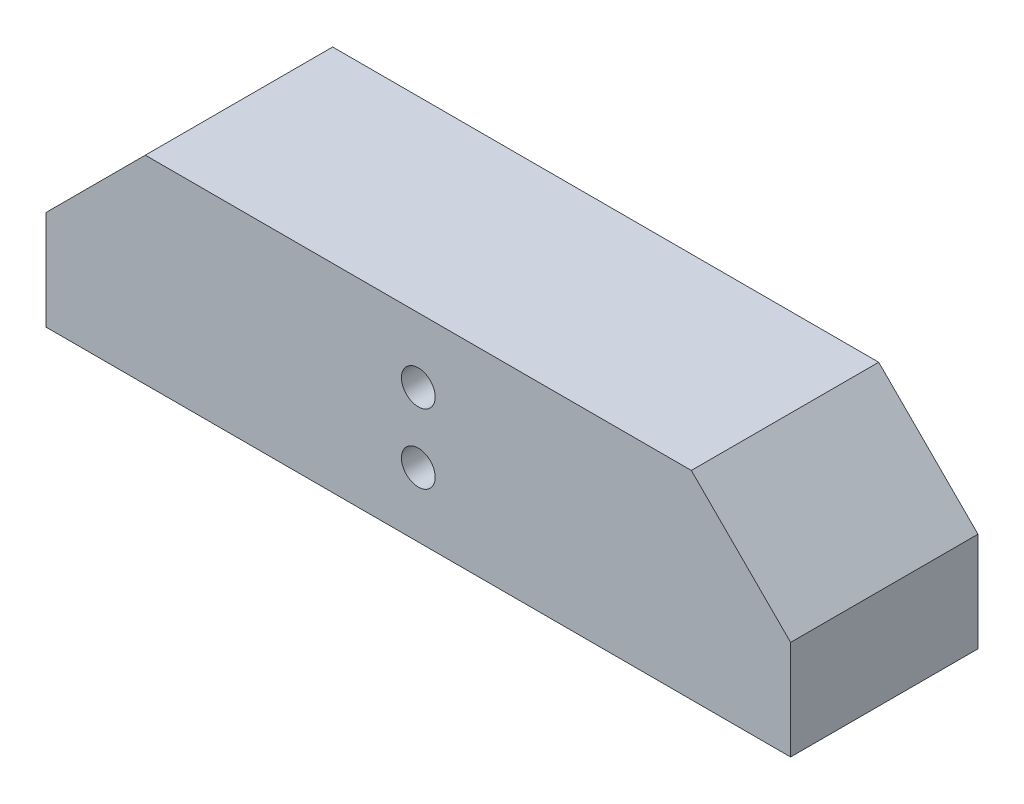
SolidWorks part; units mm, degrees
ref_plane "Front Plane" through (0, 0, 0) normal (0, 0, 1) x (1, 0, 0)
ref_plane "Top Plane" through (0, 0, 0) normal (0, 1, 0) x (1, 0, 0)
ref_plane "Right Plane" through (0, 0, 0) normal (1, 0, 0) x (0, 0, -1)
sketch "Sketch1" plane through (0, 0, 0) normal (0, 0, 1) x (1, 0, 0)
  line L0 (-31.7335, -20) -> (31.7335, -20)
  line L1 (-75, -20) -> (-58.2665, -20)
  line L2 (-75, -20) -> (-75, 20)
  line L3 (-75, 20) -> (75, 20)
  line L4 (75, -20) -> (75, 20)
  line L5 (-75, -20) -> (75, 20) construction
  line L6 (-75, 20) -> (75, -20) construction
  line L7 (58.2665, -20) -> (75, -20)
  arc A0 (-31.7335, -20) -> (-58.2665, -20) centre (-45, -13) ccw
  arc A1 (58.2665, -20) -> (31.7335, -20) centre (45, -13) ccw
  point P0 (0, 0)
  dimension "D3" = 30
  dimension "D4" = 7
  dimension "D1" = 40
  dimension "D2" = 150
  dimension "D5" = 7
  dimension "D6" = 45
  dimension "D7" = 45
extrude "Boss-Extrude1" add sketch "Sketch1" along normal blind 10
fillet "Fillet1" radius 2 4 edges at (31.7335, -20, 5) (58.2665, -20, 5) (-31.7335, -20, 5) (-58.2665, -20, 5)
sketch "Sketch2" plane through (0, 0, 10) normal (0, 0, 1) x (1, 0, 0)
  line L0 (-75, -20) -> (-61.2481, -20) construction
  arc A0 (-30.6635, -17.4118) -> (-59.3365, -17.4118) centre (-45, -13) ccw construction
  circle A1 centre (-66.9, -17) radius 1
  arc A2 (59.3365, -17.4118) -> (30.6635, -17.4118) centre (45, -13) ccw construction
  circle A3 centre (-23.1, -17) radius 1
  circle A4 centre (23.1, -17) radius 1
  circle A5 centre (66.9, -17) radius 1
  point P0 (-66.9, -17)
  point P8 (-23.1, -17)
  point P9 (66.9, -17)
  point P10 (23.1, -17)
  dimension "D1" = 21.9
  dimension "D4" = 21.9
  dimension "D6" = 2
  dimension "D2" = 3
  dimension "D3" = 21.9
  dimension "D5" = 21.9
extrude "Cut-Extrude1" cut sketch "Sketch2" against normal blind 10
sketch "Sketch4" plane through (0, 0, 10) normal (0, 0, 1) x (1, 0, 0)
  line L1 (-75, 20) -> (75, 20)
  line L2 (-75, 20) -> (-75, -20)
  line L3 (-75, -20) -> (75, -20)
  line L4 (75, 20) -> (75, -20)
extrude "Boss-Extrude3" add sketch "Sketch4" along normal blind 27.75
chamfer "Chamfer1" distance 20 angle 45 2 edges at (75, 20, 18.875) (-75, 20, 18.875)
sketch "Sketch5" plane through (0, 0, 37.75) normal (0, 0, 1) x (1, 0, 0)
  line L0 (0, 38.5905) -> (0, -40.8356) construction
  line L1 (-31.7438, 0) -> (25.8837, 0) construction
  circle A0 centre (0, 7) radius 3.4
  circle A1 centre (0, -7) radius 3.4
  point P9 (0, 0)
  dimension "D1" = 6.8
  dimension "D3" = 7
  dimension "D2" = 7
extrude "Cut-Extrude2" cut sketch "Sketch5" against normal blind 20
